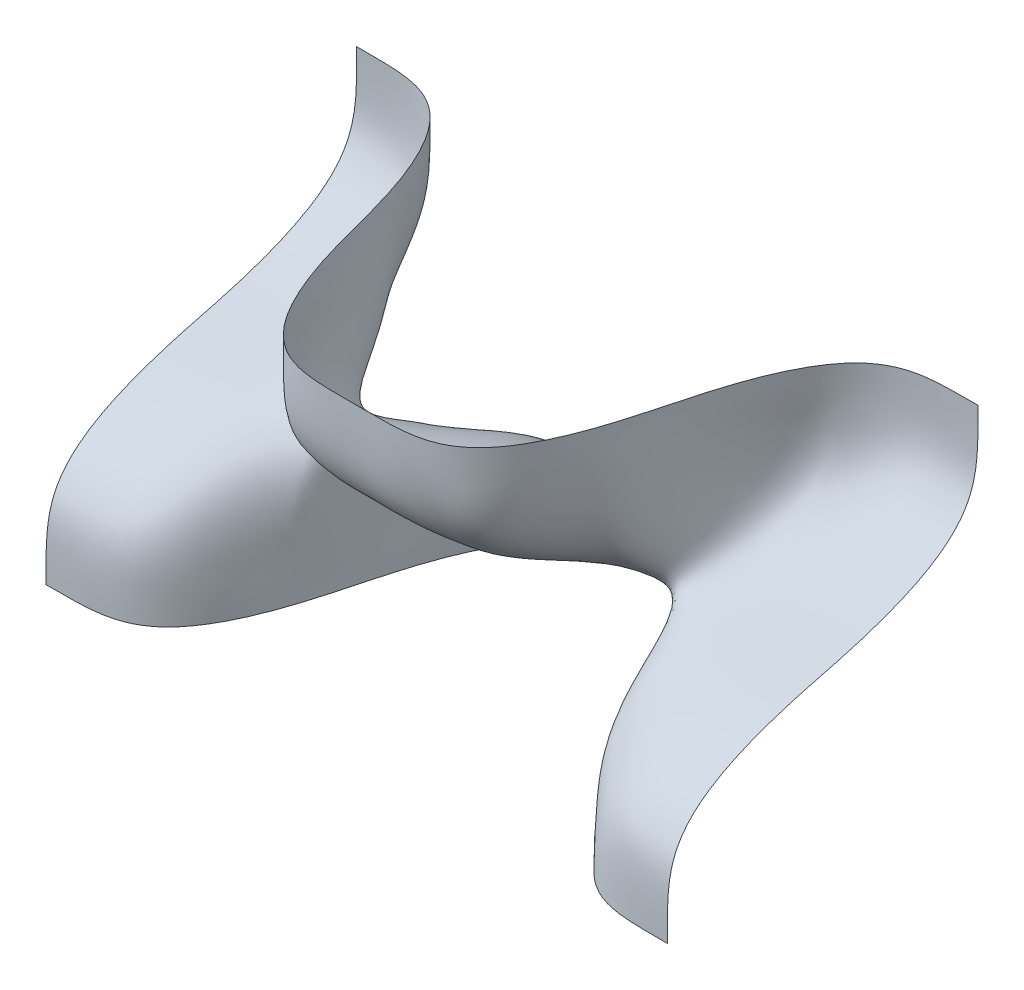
SolidWorks part; units mm, degrees
ref_plane "Ebene vorne" through (0, 0, 0) normal (0, 0, 1) x (1, 0, 0)
ref_plane "Ebene oben" through (0, 0, 0) normal (0, 1, 0) x (1, 0, 0)
ref_plane "Ebene rechts" through (0, 0, 0) normal (1, 0, 0) x (0, 0, -1)
sketch3d "3D-Skizze2"
  point P0 (-120, -120, 60)
  point P1 (-114, -120, 59.994)
  point P2 (-108, -120, 59.904)
  point P3 (-102, -120, 59.514)
  point P4 (-96, -120, 58.464)
  point P5 (-90, -120, 56.25)
  point P6 (-84, -120, 52.224)
  point P7 (-78, -120, 45.594)
  point P8 (-72, -120, 35.424)
  point P9 (-66, -120, 20.634)
  point P10 (-60, -120, 0)
  point P11 (-54, -120, -20.634)
  point P12 (-48, -120, -35.424)
  point P13 (-42, -120, -45.594)
  point P14 (-36, -120, -52.224)
  point P15 (-30, -120, -56.25)
  point P16 (-24, -120, -58.464)
  point P17 (-18, -120, -59.514)
  point P18 (-12, -120, -59.904)
  point P19 (-6, -120, -59.994)
  point P20 (0, -120, -60)
  point P21 (6, -120, -59.994)
  point P22 (12, -120, -59.904)
  point P23 (18, -120, -59.514)
  point P24 (24, -120, -58.464)
  point P25 (30, -120, -56.25)
  point P26 (36, -120, -52.224)
  point P27 (42, -120, -45.594)
  point P28 (48, -120, -35.424)
  point P29 (54, -120, -20.634)
  point P30 (60, -120, 0)
  point P31 (66, -120, 20.634)
  point P32 (72, -120, 35.424)
  point P33 (78, -120, 45.594)
  point P34 (84, -120, 52.224)
  point P35 (90, -120, 56.25)
  point P36 (96, -120, 58.464)
  point P37 (102, -120, 59.514)
  point P38 (108, -120, 59.904)
  point P39 (114, -120, 59.994)
  point P40 (120, -120, 60)
  point P41 (-120, -117, 59.9996)
  point P42 (-114, -117, 59.9936)
  point P43 (-108, -117, 59.9036)
  point P44 (-102, -117, 59.5136)
  point P45 (-96, -117, 58.4636)
  point P46 (-90, -117, 56.2496)
  point P47 (-84, -117, 52.2237)
  point P48 (-78, -117, 45.5937)
  point P49 (-72, -117, 35.4238)
  point P50 (-66, -117, 20.6339)
  point P51 (-60, -117, 0)
  point P52 (-54, -117, -20.6339)
  point P53 (-48, -117, -35.4238)
  point P54 (-42, -117, -45.5937)
  point P55 (-36, -117, -52.2237)
  point P56 (-30, -117, -56.2496)
  point P57 (-24, -117, -58.4636)
  point P58 (-18, -117, -59.5136)
  point P59 (-12, -117, -59.9036)
  point P60 (-6, -117, -59.9936)
  point P61 (0, -117, -59.9996)
  point P62 (6, -117, -59.9936)
  point P63 (12, -117, -59.9036)
  point P64 (18, -117, -59.5136)
  point P65 (24, -117, -58.4636)
  point P66 (30, -117, -56.2496)
  point P67 (36, -117, -52.2237)
  point P68 (42, -117, -45.5937)
  point P69 (48, -117, -35.4238)
  point P70 (54, -117, -20.6339)
  point P71 (60, -117, 0)
  point P72 (66, -117, 20.6339)
  point P73 (72, -117, 35.4238)
  point P74 (78, -117, 45.5937)
  point P75 (84, -117, 52.2237)
  point P76 (90, -117, 56.2496)
  point P77 (96, -117, 58.4636)
  point P78 (102, -117, 59.5136)
  point P79 (108, -117, 59.9036)
  point P80 (114, -117, 59.9936)
  point P81 (120, -117, 59.9996)
  point P82 (-120, -114, 59.994)
  point P83 (-114, -114, 59.988)
  point P84 (-108, -114, 59.898)
  point P85 (-102, -114, 59.508)
  point P86 (-96, -114, 58.4582)
  point P87 (-90, -114, 56.2444)
  point P88 (-84, -114, 52.2188)
  point P89 (-78, -114, 45.5894)
  point P90 (-72, -114, 35.4205)
  point P91 (-66, -114, 20.6319)
  point P92 (-60, -114, 0)
  point P93 (-54, -114, -20.6319)
  point P94 (-48, -114, -35.4205)
  point P95 (-42, -114, -45.5894)
  point P96 (-36, -114, -52.2188)
  point P97 (-30, -114, -56.2444)
  point P98 (-24, -114, -58.4582)
  point P99 (-18, -114, -59.508)
  point P100 (-12, -114, -59.898)
  point P101 (-6, -114, -59.988)
  point P102 (0, -114, -59.994)
  point P103 (6, -114, -59.988)
  point P104 (12, -114, -59.898)
  point P105 (18, -114, -59.508)
  point P106 (24, -114, -58.4582)
  point P107 (30, -114, -56.2444)
  point P108 (36, -114, -52.2188)
  point P109 (42, -114, -45.5894)
  point P110 (48, -114, -35.4205)
  point P111 (54, -114, -20.6319)
  point P112 (60, -114, 0)
  point P113 (66, -114, 20.6319)
  point P114 (72, -114, 35.4205)
  point P115 (78, -114, 45.5894)
  point P116 (84, -114, 52.2188)
  point P117 (90, -114, 56.2444)
  point P118 (96, -114, 58.4582)
  point P119 (102, -114, 59.508)
  point P120 (108, -114, 59.898)
  point P121 (114, -114, 59.988)
  point P122 (120, -114, 59.994)
  point P123 (-120, -111, 59.9696)
  point P124 (-114, -111, 59.9636)
  point P125 (-108, -111, 59.8737)
  point P126 (-102, -111, 59.4839)
  point P127 (-96, -111, 58.4344)
  point P128 (-90, -111, 56.2215)
  point P129 (-84, -111, 52.1976)
  point P130 (-78, -111, 45.5709)
  point P131 (-72, -111, 35.4061)
  point P132 (-66, -111, 20.6236)
  point P133 (-60, -111, 0)
  point P134 (-54, -111, -20.6236)
  point P135 (-48, -111, -35.4061)
  point P136 (-42, -111, -45.5709)
  point P137 (-36, -111, -52.1976)
  point P138 (-30, -111, -56.2215)
  point P139 (-24, -111, -58.4344)
  point P140 (-18, -111, -59.4839)
  point P141 (-12, -111, -59.8737)
  point P142 (-6, -111, -59.9636)
  point P143 (0, -111, -59.9696)
  point P144 (6, -111, -59.9636)
  point P145 (12, -111, -59.8737)
  point P146 (18, -111, -59.4839)
  point P147 (24, -111, -58.4344)
  point P148 (30, -111, -56.2215)
  point P149 (36, -111, -52.1976)
  point P150 (42, -111, -45.5709)
  point P151 (48, -111, -35.4061)
  point P152 (54, -111, -20.6236)
  point P153 (60, -111, 0)
  point P154 (66, -111, 20.6236)
  point P155 (72, -111, 35.4061)
  point P156 (78, -111, 45.5709)
  point P157 (84, -111, 52.1976)
  point P158 (90, -111, 56.2215)
  point P159 (96, -111, 58.4344)
  point P160 (102, -111, 59.4839)
  point P161 (108, -111, 59.8737)
  point P162 (114, -111, 59.9636)
  point P163 (120, -111, 59.9696)
  point P164 (-120, -108, 59.904)
  point P165 (-114, -108, 59.898)
  point P166 (-108, -108, 59.8082)
  point P167 (-102, -108, 59.4188)
  point P168 (-96, -108, 58.3705)
  point P169 (-90, -108, 56.16)
  point P170 (-84, -108, 52.1404)
  point P171 (-78, -108, 45.521)
  point P172 (-72, -108, 35.3673)
  point P173 (-66, -108, 20.601)
  point P174 (-60, -108, 0)
  point P175 (-54, -108, -20.601)
  point P176 (-48, -108, -35.3673)
  point P177 (-42, -108, -45.521)
  point P178 (-36, -108, -52.1404)
  point P179 (-30, -108, -56.16)
  point P180 (-24, -108, -58.3705)
  point P181 (-18, -108, -59.4188)
  point P182 (-12, -108, -59.8082)
  point P183 (-6, -108, -59.898)
  point P184 (0, -108, -59.904)
  point P185 (6, -108, -59.898)
  point P186 (12, -108, -59.8082)
  point P187 (18, -108, -59.4188)
  point P188 (24, -108, -58.3705)
  point P189 (30, -108, -56.16)
  point P190 (36, -108, -52.1404)
  point P191 (42, -108, -45.521)
  point P192 (48, -108, -35.3673)
  point P193 (54, -108, -20.601)
  point P194 (60, -108, 0)
  point P195 (66, -108, 20.601)
  point P196 (72, -108, 35.3673)
  point P197 (78, -108, 45.521)
  point P198 (84, -108, 52.1404)
  point P199 (90, -108, 56.16)
  point P200 (96, -108, 58.3705)
  point P201 (102, -108, 59.4188)
  point P202 (108, -108, 59.8082)
  point P203 (114, -108, 59.898)
  point P204 (120, -108, 59.904)
  point P205 (-120, -105, 59.7656)
  point P206 (-114, -105, 59.7596)
  point P207 (-108, -105, 59.67)
  point P208 (-102, -105, 59.2815)
  point P209 (-96, -105, 58.2356)
  point P210 (-90, -105, 56.0303)
  point P211 (-84, -105, 52.02)
  point P212 (-78, -105, 45.4159)
  point P213 (-72, -105, 35.2856)
  point P214 (-66, -105, 20.5534)
  point P215 (-60, -105, 0)
  point P216 (-54, -105, -20.5534)
  point P217 (-48, -105, -35.2856)
  point P218 (-42, -105, -45.4159)
  point P219 (-36, -105, -52.02)
  point P220 (-30, -105, -56.0303)
  point P221 (-24, -105, -58.2356)
  point P222 (-18, -105, -59.2815)
  point P223 (-12, -105, -59.67)
  point P224 (-6, -105, -59.7596)
  point P225 (0, -105, -59.7656)
  point P226 (6, -105, -59.7596)
  point P227 (12, -105, -59.67)
  point P228 (18, -105, -59.2815)
  point P229 (24, -105, -58.2356)
  point P230 (30, -105, -56.0303)
  point P231 (36, -105, -52.02)
  point P232 (42, -105, -45.4159)
  point P233 (48, -105, -35.2856)
  point P234 (54, -105, -20.5534)
  point P235 (60, -105, 0)
  point P236 (66, -105, 20.5534)
  point P237 (72, -105, 35.2856)
  point P238 (78, -105, 45.4159)
  point P239 (84, -105, 52.02)
  point P240 (90, -105, 56.0303)
  point P241 (96, -105, 58.2356)
  point P242 (102, -105, 59.2815)
  point P243 (108, -105, 59.67)
  point P244 (114, -105, 59.7596)
  point P245 (120, -105, 59.7656)
  point P246 (-120, -102, 59.514)
  point P247 (-114, -102, 59.508)
  point P248 (-108, -102, 59.4188)
  point P249 (-102, -102, 59.0319)
  point P250 (-96, -102, 57.9904)
  point P251 (-90, -102, 55.7944)
  point P252 (-84, -102, 51.801)
  point P253 (-78, -102, 45.2247)
  point P254 (-72, -102, 35.1371)
  point P255 (-66, -102, 20.4669)
  point P256 (-60, -102, 0)
  point P257 (-54, -102, -20.4669)
  point P258 (-48, -102, -35.1371)
  point P259 (-42, -102, -45.2247)
  point P260 (-36, -102, -51.801)
  point P261 (-30, -102, -55.7944)
  point P262 (-24, -102, -57.9904)
  point P263 (-18, -102, -59.0319)
  point P264 (-12, -102, -59.4188)
  point P265 (-6, -102, -59.508)
  point P266 (0, -102, -59.514)
  point P267 (6, -102, -59.508)
  point P268 (12, -102, -59.4188)
  point P269 (18, -102, -59.0319)
  point P270 (24, -102, -57.9904)
  point P271 (30, -102, -55.7944)
  point P272 (36, -102, -51.801)
  point P273 (42, -102, -45.2247)
  point P274 (48, -102, -35.1371)
  point P275 (54, -102, -20.4669)
  point P276 (60, -102, 0)
  point P277 (66, -102, 20.4669)
  point P278 (72, -102, 35.1371)
  point P279 (78, -102, 45.2247)
  point P280 (84, -102, 51.801)
  point P281 (90, -102, 55.7944)
  point P282 (96, -102, 57.9904)
  point P283 (102, -102, 59.0319)
  point P284 (108, -102, 59.4188)
  point P285 (114, -102, 59.508)
  point P286 (120, -102, 59.514)
  point P287 (-120, -99, 59.0996)
  point P288 (-114, -99, 59.0937)
  point P289 (-108, -99, 59.0051)
  point P290 (-102, -99, 58.6209)
  point P291 (-96, -99, 57.5867)
  point P292 (-90, -99, 55.4059)
  point P293 (-84, -99, 51.4403)
  point P294 (-78, -99, 44.9098)
  point P295 (-72, -99, 34.8924)
  point P296 (-66, -99, 20.3244)
  point P297 (-60, -99, 0)
  point P298 (-54, -99, -20.3244)
  point P299 (-48, -99, -34.8924)
  point P300 (-42, -99, -44.9098)
  point P301 (-36, -99, -51.4403)
  point P302 (-30, -99, -55.4059)
  point P303 (-24, -99, -57.5867)
  point P304 (-18, -99, -58.6209)
  point P305 (-12, -99, -59.0051)
  point P306 (-6, -99, -59.0937)
  point P307 (0, -99, -59.0996)
  point P308 (6, -99, -59.0937)
  point P309 (12, -99, -59.0051)
  point P310 (18, -99, -58.6209)
  point P311 (24, -99, -57.5867)
  point P312 (30, -99, -55.4059)
  point P313 (36, -99, -51.4403)
  point P314 (42, -99, -44.9098)
  point P315 (48, -99, -34.8924)
  point P316 (54, -99, -20.3244)
  point P317 (60, -99, 0)
  point P318 (66, -99, 20.3244)
  point P319 (72, -99, 34.8924)
  point P320 (78, -99, 44.9098)
  point P321 (84, -99, 51.4403)
  point P322 (90, -99, 55.4059)
  point P323 (96, -99, 57.5867)
  point P324 (102, -99, 58.6209)
  point P325 (108, -99, 59.0051)
  point P326 (114, -99, 59.0937)
  point P327 (120, -99, 59.0996)
  point P328 (-120, -96, 58.464)
  point P329 (-114, -96, 58.4582)
  point P330 (-108, -96, 58.3705)
  point P331 (-102, -96, 57.9904)
  point P332 (-96, -96, 56.9673)
  point P333 (-90, -96, 54.81)
  point P334 (-84, -96, 50.8871)
  point P335 (-78, -96, 44.4268)
  point P336 (-72, -96, 34.5171)
  point P337 (-66, -96, 20.1058)
  point P338 (-60, -96, 0)
  point P339 (-54, -96, -20.1058)
  point P340 (-48, -96, -34.5171)
  point P341 (-42, -96, -44.4268)
  point P342 (-36, -96, -50.8871)
  point P343 (-30, -96, -54.81)
  point P344 (-24, -96, -56.9673)
  point P345 (-18, -96, -57.9904)
  point P346 (-12, -96, -58.3705)
  point P347 (-6, -96, -58.4582)
  point P348 (0, -96, -58.464)
  point P349 (6, -96, -58.4582)
  point P350 (12, -96, -58.3705)
  point P351 (18, -96, -57.9904)
  point P352 (24, -96, -56.9673)
  point P353 (30, -96, -54.81)
  point P354 (36, -96, -50.8871)
  point P355 (42, -96, -44.4268)
  point P356 (48, -96, -34.5171)
  point P357 (54, -96, -20.1058)
  point P358 (60, -96, 0)
  point P359 (66, -96, 20.1058)
  point P360 (72, -96, 34.5171)
  point P361 (78, -96, 44.4268)
  point P362 (84, -96, 50.8871)
  point P363 (90, -96, 54.81)
  point P364 (96, -96, 56.9673)
  point P365 (102, -96, 57.9904)
  point P366 (108, -96, 58.3705)
  point P367 (114, -96, 58.4582)
  point P368 (120, -96, 58.464)
  point P369 (-120, -93, 57.5396)
  point P370 (-114, -93, 57.5339)
  point P371 (-108, -93, 57.4476)
  point P372 (-102, -93, 57.0736)
  point P373 (-96, -93, 56.0666)
  point P374 (-90, -93, 53.9434)
  point P375 (-84, -93, 50.0825)
  point P376 (-78, -93, 43.7244)
  point P377 (-72, -93, 33.9714)
  point P378 (-66, -93, 19.7879)
  point P379 (-60, -93, 0)
  point P380 (-54, -93, -19.7879)
  point P381 (-48, -93, -33.9714)
  point P382 (-42, -93, -43.7244)
  point P383 (-36, -93, -50.0825)
  point P384 (-30, -93, -53.9434)
  point P385 (-24, -93, -56.0666)
  point P386 (-18, -93, -57.0736)
  point P387 (-12, -93, -57.4476)
  point P388 (-6, -93, -57.5339)
  point P389 (0, -93, -57.5396)
  point P390 (6, -93, -57.5339)
  point P391 (12, -93, -57.4476)
  point P392 (18, -93, -57.0736)
  point P393 (24, -93, -56.0666)
  point P394 (30, -93, -53.9434)
  point P395 (36, -93, -50.0825)
  point P396 (42, -93, -43.7244)
  point P397 (48, -93, -33.9714)
  point P398 (54, -93, -19.7879)
  point P399 (60, -93, 0)
  point P400 (66, -93, 19.7879)
  point P401 (72, -93, 33.9714)
  point P402 (78, -93, 43.7244)
  point P403 (84, -93, 50.0825)
  point P404 (90, -93, 53.9434)
  point P405 (96, -93, 56.0666)
  point P406 (102, -93, 57.0736)
  point P407 (108, -93, 57.4476)
  point P408 (114, -93, 57.5339)
  point P409 (120, -93, 57.5396)
  point P410 (-120, -90, 56.25)
  point P411 (-114, -90, 56.2444)
  point P412 (-108, -90, 56.16)
  point P413 (-102, -90, 55.7944)
  point P414 (-96, -90, 54.81)
  point P415 (-90, -90, 52.7344)
  point P416 (-84, -90, 48.96)
  point P417 (-78, -90, 42.7444)
  point P418 (-72, -90, 33.21)
  point P419 (-66, -90, 19.3444)
  point P420 (-60, -90, 0)
  point P421 (-54, -90, -19.3444)
  point P422 (-48, -90, -33.21)
  point P423 (-42, -90, -42.7444)
  point P424 (-36, -90, -48.96)
  point P425 (-30, -90, -52.7344)
  point P426 (-24, -90, -54.81)
  point P427 (-18, -90, -55.7944)
  point P428 (-12, -90, -56.16)
  point P429 (-6, -90, -56.2444)
  point P430 (0, -90, -56.25)
  point P431 (6, -90, -56.2444)
  point P432 (12, -90, -56.16)
  point P433 (18, -90, -55.7944)
  point P434 (24, -90, -54.81)
  point P435 (30, -90, -52.7344)
  point P436 (36, -90, -48.96)
  point P437 (42, -90, -42.7444)
  point P438 (48, -90, -33.21)
  point P439 (54, -90, -19.3444)
  point P440 (60, -90, 0)
  point P441 (66, -90, 19.3444)
  point P442 (72, -90, 33.21)
  point P443 (78, -90, 42.7444)
  point P444 (84, -90, 48.96)
  point P445 (90, -90, 52.7344)
  point P446 (96, -90, 54.81)
  point P447 (102, -90, 55.7944)
  point P448 (108, -90, 56.16)
  point P449 (114, -90, 56.2444)
  point P450 (120, -90, 56.25)
  point P451 (-120, -87, 54.5096)
  point P452 (-114, -87, 54.5042)
  point P453 (-108, -87, 54.4224)
  point P454 (-102, -87, 54.0681)
  point P455 (-96, -87, 53.1142)
  point P456 (-90, -87, 51.1028)
  point P457 (-84, -87, 47.4452)
  point P458 (-78, -87, 41.4219)
  point P459 (-72, -87, 32.1825)
  point P460 (-66, -87, 18.7459)
  point P461 (-60, -87, 0)
  point P462 (-54, -87, -18.7459)
  point P463 (-48, -87, -32.1825)
  point P464 (-42, -87, -41.4219)
  point P465 (-36, -87, -47.4452)
  point P466 (-30, -87, -51.1028)
  point P467 (-24, -87, -53.1142)
  point P468 (-18, -87, -54.0681)
  point P469 (-12, -87, -54.4224)
  point P470 (-6, -87, -54.5042)
  point P471 (0, -87, -54.5096)
  point P472 (6, -87, -54.5042)
  point P473 (12, -87, -54.4224)
  point P474 (18, -87, -54.0681)
  point P475 (24, -87, -53.1142)
  point P476 (30, -87, -51.1028)
  point P477 (36, -87, -47.4452)
  point P478 (42, -87, -41.4219)
  point P479 (48, -87, -32.1825)
  point P480 (54, -87, -18.7459)
  point P481 (60, -87, 0)
  point P482 (66, -87, 18.7459)
  point P483 (72, -87, 32.1825)
  point P484 (78, -87, 41.4219)
  point P485 (84, -87, 47.4452)
  point P486 (90, -87, 51.1028)
  point P487 (96, -87, 53.1142)
  point P488 (102, -87, 54.0681)
  point P489 (108, -87, 54.4224)
  point P490 (114, -87, 54.5042)
  point P491 (120, -87, 54.5096)
  point P492 (-120, -84, 52.224)
  point P493 (-114, -84, 52.2188)
  point P494 (-108, -84, 52.1404)
  point P495 (-102, -84, 51.801)
  point P496 (-96, -84, 50.8871)
  point P497 (-90, -84, 48.96)
  point P498 (-84, -84, 45.4558)
  point P499 (-78, -84, 39.685)
  point P500 (-72, -84, 30.833)
  point P501 (-66, -84, 17.9598)
  point P502 (-60, -84, 0)
  point P503 (-54, -84, -17.9598)
  point P504 (-48, -84, -30.833)
  point P505 (-42, -84, -39.685)
  point P506 (-36, -84, -45.4558)
  point P507 (-30, -84, -48.96)
  point P508 (-24, -84, -50.8871)
  point P509 (-18, -84, -51.801)
  point P510 (-12, -84, -52.1404)
  point P511 (-6, -84, -52.2188)
  point P512 (0, -84, -52.224)
  point P513 (6, -84, -52.2188)
  point P514 (12, -84, -52.1404)
  point P515 (18, -84, -51.801)
  point P516 (24, -84, -50.8871)
  point P517 (30, -84, -48.96)
  point P518 (36, -84, -45.4558)
  point P519 (42, -84, -39.685)
  point P520 (48, -84, -30.833)
  point P521 (54, -84, -17.9598)
  point P522 (60, -84, 0)
  point P523 (66, -84, 17.9598)
  point P524 (72, -84, 30.833)
  point P525 (78, -84, 39.685)
  point P526 (84, -84, 45.4558)
  point P527 (90, -84, 48.96)
  point P528 (96, -84, 50.8871)
  point P529 (102, -84, 51.801)
  point P530 (108, -84, 52.1404)
  point P531 (114, -84, 52.2188)
  point P532 (120, -84, 52.224)
  point P533 (-120, -81, 49.2896)
  point P534 (-114, -81, 49.2847)
  point P535 (-108, -81, 49.2108)
  point P536 (-102, -81, 48.8904)
  point P537 (-96, -81, 48.0278)
  point P538 (-90, -81, 46.209)
  point P539 (-84, -81, 42.9017)
  point P540 (-78, -81, 37.4552)
  point P541 (-72, -81, 29.1006)
  point P542 (-66, -81, 16.9507)
  point P543 (-60, -81, 0)
  point P544 (-54, -81, -16.9507)
  point P545 (-48, -81, -29.1006)
  point P546 (-42, -81, -37.4552)
  point P547 (-36, -81, -42.9017)
  point P548 (-30, -81, -46.209)
  point P549 (-24, -81, -48.0278)
  point P550 (-18, -81, -48.8904)
  point P551 (-12, -81, -49.2108)
  point P552 (-6, -81, -49.2847)
  point P553 (0, -81, -49.2896)
  point P554 (6, -81, -49.2847)
  point P555 (12, -81, -49.2108)
  point P556 (18, -81, -48.8904)
  point P557 (24, -81, -48.0278)
  point P558 (30, -81, -46.209)
  point P559 (36, -81, -42.9017)
  point P560 (42, -81, -37.4552)
  point P561 (48, -81, -29.1006)
  point P562 (54, -81, -16.9507)
  point P563 (60, -81, 0)
  point P564 (66, -81, 16.9507)
  point P565 (72, -81, 29.1006)
  point P566 (78, -81, 37.4552)
  point P567 (84, -81, 42.9017)
  point P568 (90, -81, 46.209)
  point P569 (96, -81, 48.0278)
  point P570 (102, -81, 48.8904)
  point P571 (108, -81, 49.2108)
  point P572 (114, -81, 49.2847)
  point P573 (120, -81, 49.2896)
  point P574 (-120, -78, 45.594)
  point P575 (-114, -78, 45.5894)
  point P576 (-108, -78, 45.521)
  point P577 (-102, -78, 45.2247)
  point P578 (-96, -78, 44.4268)
  point P579 (-90, -78, 42.7444)
  point P580 (-84, -78, 39.685)
  point P581 (-78, -78, 34.6469)
  point P582 (-72, -78, 26.9187)
  point P583 (-66, -78, 15.6798)
  point P584 (-60, -78, 0)
  point P585 (-54, -78, -15.6798)
  point P586 (-48, -78, -26.9187)
  point P587 (-42, -78, -34.6469)
  point P588 (-36, -78, -39.685)
  point P589 (-30, -78, -42.7444)
  point P590 (-24, -78, -44.4268)
  point P591 (-18, -78, -45.2247)
  point P592 (-12, -78, -45.521)
  point P593 (-6, -78, -45.5894)
  point P594 (0, -78, -45.594)
  point P595 (6, -78, -45.5894)
  point P596 (12, -78, -45.521)
  point P597 (18, -78, -45.2247)
  point P598 (24, -78, -44.4268)
  point P599 (30, -78, -42.7444)
  point P600 (36, -78, -39.685)
  point P601 (42, -78, -34.6469)
  point P602 (48, -78, -26.9187)
  point P603 (54, -78, -15.6798)
  point P604 (60, -78, 0)
  point P605 (66, -78, 15.6798)
  point P606 (72, -78, 26.9187)
  point P607 (78, -78, 34.6469)
  point P608 (84, -78, 39.685)
  point P609 (90, -78, 42.7444)
  point P610 (96, -78, 44.4268)
  point P611 (102, -78, 45.2247)
  point P612 (108, -78, 45.521)
  point P613 (114, -78, 45.5894)
  point P614 (120, -78, 45.594)
  point P615 (-120, -75, 41.0156)
  point P616 (-114, -75, 41.0115)
  point P617 (-108, -75, 40.95)
  point P618 (-102, -75, 40.6834)
  point P619 (-96, -75, 39.9656)
  point P620 (-90, -75, 38.4521)
  point P621 (-84, -75, 35.7)
  point P622 (-78, -75, 31.1678)
  point P623 (-72, -75, 24.2156)
  point P624 (-66, -75, 14.1053)
  point P625 (-60, -75, 0)
  point P626 (-54, -75, -14.1053)
  point P627 (-48, -75, -24.2156)
  point P628 (-42, -75, -31.1678)
  point P629 (-36, -75, -35.7)
  point P630 (-30, -75, -38.4521)
  point P631 (-24, -75, -39.9656)
  point P632 (-18, -75, -40.6834)
  point P633 (-12, -75, -40.95)
  point P634 (-6, -75, -41.0115)
  point P635 (0, -75, -41.0156)
  point P636 (6, -75, -41.0115)
  point P637 (12, -75, -40.95)
  point P638 (18, -75, -40.6834)
  point P639 (24, -75, -39.9656)
  point P640 (30, -75, -38.4521)
  point P641 (36, -75, -35.7)
  point P642 (42, -75, -31.1678)
  point P643 (48, -75, -24.2156)
  point P644 (54, -75, -14.1053)
  point P645 (60, -75, 0)
  point P646 (66, -75, 14.1053)
  point P647 (72, -75, 24.2156)
  point P648 (78, -75, 31.1678)
  point P649 (84, -75, 35.7)
  point P650 (90, -75, 38.4521)
  point P651 (96, -75, 39.9656)
  point P652 (102, -75, 40.6834)
  point P653 (108, -75, 40.95)
  point P654 (114, -75, 41.0115)
  point P655 (120, -75, 41.0156)
  point P656 (-120, -72, 35.424)
  point P657 (-114, -72, 35.4205)
  point P658 (-108, -72, 35.3673)
  point P659 (-102, -72, 35.1371)
  point P660 (-96, -72, 34.5171)
  point P661 (-90, -72, 33.21)
  point P662 (-84, -72, 30.833)
  point P663 (-78, -72, 26.9187)
  point P664 (-72, -72, 20.9143)
  point P665 (-66, -72, 12.1823)
  point P666 (-60, -72, 0)
  point P667 (-54, -72, -12.1823)
  point P668 (-48, -72, -20.9143)
  point P669 (-42, -72, -26.9187)
  point P670 (-36, -72, -30.833)
  point P671 (-30, -72, -33.21)
  point P672 (-24, -72, -34.5171)
  point P673 (-18, -72, -35.1371)
  point P674 (-12, -72, -35.3673)
  point P675 (-6, -72, -35.4205)
  point P676 (0, -72, -35.424)
  point P677 (6, -72, -35.4205)
  point P678 (12, -72, -35.3673)
  point P679 (18, -72, -35.1371)
  point P680 (24, -72, -34.5171)
  point P681 (30, -72, -33.21)
  point P682 (36, -72, -30.833)
  point P683 (42, -72, -26.9187)
  point P684 (48, -72, -20.9143)
  point P685 (54, -72, -12.1823)
  point P686 (60, -72, 0)
  point P687 (66, -72, 12.1823)
  point P688 (72, -72, 20.9143)
  point P689 (78, -72, 26.9187)
  point P690 (84, -72, 30.833)
  point P691 (90, -72, 33.21)
  point P692 (96, -72, 34.5171)
  point P693 (102, -72, 35.1371)
  point P694 (108, -72, 35.3673)
  point P695 (114, -72, 35.4205)
  point P696 (120, -72, 35.424)
  point P697 (-120, -69, 28.6796)
  point P698 (-114, -69, 28.6768)
  point P699 (-108, -69, 28.6337)
  point P700 (-102, -69, 28.4473)
  point P701 (-96, -69, 27.9454)
  point P702 (-90, -69, 26.8871)
  point P703 (-84, -69, 24.9627)
  point P704 (-78, -69, 21.7936)
  point P705 (-72, -69, 16.9325)
  point P706 (-66, -69, 9.8629)
  point P707 (-60, -69, 0)
  point P708 (-54, -69, -9.8629)
  point P709 (-48, -69, -16.9325)
  point P710 (-42, -69, -21.7936)
  point P711 (-36, -69, -24.9627)
  point P712 (-30, -69, -26.8871)
  point P713 (-24, -69, -27.9454)
  point P714 (-18, -69, -28.4473)
  point P715 (-12, -69, -28.6337)
  point P716 (-6, -69, -28.6768)
  point P717 (0, -69, -28.6796)
  point P718 (6, -69, -28.6768)
  point P719 (12, -69, -28.6337)
  point P720 (18, -69, -28.4473)
  point P721 (24, -69, -27.9454)
  point P722 (30, -69, -26.8871)
  point P723 (36, -69, -24.9627)
  point P724 (42, -69, -21.7936)
  point P725 (48, -69, -16.9325)
  point P726 (54, -69, -9.8629)
  point P727 (60, -69, 0)
  point P728 (66, -69, 9.8629)
  point P729 (72, -69, 16.9325)
  point P730 (78, -69, 21.7936)
  point P731 (84, -69, 24.9627)
  point P732 (90, -69, 26.8871)
  point P733 (96, -69, 27.9454)
  point P734 (102, -69, 28.4473)
  point P735 (108, -69, 28.6337)
  point P736 (114, -69, 28.6768)
  point P737 (120, -69, 28.6796)
  point P738 (-120, -66, 20.634)
  point P739 (-114, -66, 20.6319)
  point P740 (-108, -66, 20.601)
  point P741 (-102, -66, 20.4669)
  point P742 (-96, -66, 20.1058)
  point P743 (-90, -66, 19.3444)
  point P744 (-84, -66, 17.9598)
  point P745 (-78, -66, 15.6798)
  point P746 (-72, -66, 12.1823)
  point P747 (-66, -66, 7.096)
  point P748 (-60, -66, 0)
  point P749 (-54, -66, -7.096)
  point P750 (-48, -66, -12.1823)
  point P751 (-42, -66, -15.6798)
  point P752 (-36, -66, -17.9598)
  point P753 (-30, -66, -19.3444)
  point P754 (-24, -66, -20.1058)
  point P755 (-18, -66, -20.4669)
  point P756 (-12, -66, -20.601)
  point P757 (-6, -66, -20.6319)
  point P758 (0, -66, -20.634)
  point P759 (6, -66, -20.6319)
  point P760 (12, -66, -20.601)
  point P761 (18, -66, -20.4669)
  point P762 (24, -66, -20.1058)
  point P763 (30, -66, -19.3444)
  point P764 (36, -66, -17.9598)
  point P765 (42, -66, -15.6798)
  point P766 (48, -66, -12.1823)
  point P767 (54, -66, -7.096)
  point P768 (60, -66, 0)
  point P769 (66, -66, 7.096)
  point P770 (72, -66, 12.1823)
  point P771 (78, -66, 15.6798)
  point P772 (84, -66, 17.9598)
  point P773 (90, -66, 19.3444)
  point P774 (96, -66, 20.1058)
  point P775 (102, -66, 20.4669)
  point P776 (108, -66, 20.601)
  point P777 (114, -66, 20.6319)
  point P778 (120, -66, 20.634)
  point P779 (-120, -63, 11.1296)
  point P780 (-114, -63, 11.1285)
  point P781 (-108, -63, 11.1118)
  point P782 (-102, -63, 11.0395)
  point P783 (-96, -63, 10.8447)
  point P784 (-90, -63, 10.434)
  point P785 (-84, -63, 9.6872)
  point P786 (-78, -63, 8.4574)
  point P787 (-72, -63, 6.5709)
  point P788 (-66, -63, 3.8275)
  point P789 (-60, -63, 0)
  point P790 (-54, -63, -3.8275)
  point P791 (-48, -63, -6.5709)
  point P792 (-42, -63, -8.4574)
  point P793 (-36, -63, -9.6872)
  point P794 (-30, -63, -10.434)
  point P795 (-24, -63, -10.8447)
  point P796 (-18, -63, -11.0395)
  point P797 (-12, -63, -11.1118)
  point P798 (-6, -63, -11.1285)
  point P799 (0, -63, -11.1296)
  point P800 (6, -63, -11.1285)
  point P801 (12, -63, -11.1118)
  point P802 (18, -63, -11.0395)
  point P803 (24, -63, -10.8447)
  point P804 (30, -63, -10.434)
  point P805 (36, -63, -9.6872)
  point P806 (42, -63, -8.4574)
  point P807 (48, -63, -6.5709)
  point P808 (54, -63, -3.8275)
  point P809 (60, -63, 0)
  point P810 (66, -63, 3.8275)
  point P811 (72, -63, 6.5709)
  point P812 (78, -63, 8.4574)
  point P813 (84, -63, 9.6872)
  point P814 (90, -63, 10.434)
  point P815 (96, -63, 10.8447)
  point P816 (102, -63, 11.0395)
  point P817 (108, -63, 11.1118)
  point P818 (114, -63, 11.1285)
  point P819 (120, -63, 11.1296)
  point P820 (-120, -60, 0)
  point P821 (-114, -60, 0)
  point P822 (-108, -60, 0)
  point P823 (-102, -60, 0)
  point P824 (-96, -60, 0)
  point P825 (-90, -60, 0)
  point P826 (-84, -60, 0)
  point P827 (-78, -60, 0)
  point P828 (-72, -60, 0)
  point P829 (-66, -60, 0)
  point P830 (-60, -60, 0)
  point P831 (-54, -60, 0)
  point P832 (-48, -60, 0)
  point P833 (-42, -60, 0)
  point P834 (-36, -60, 0)
  point P835 (-30, -60, 0)
  point P836 (-24, -60, 0)
  point P837 (-18, -60, 0)
  point P838 (-12, -60, 0)
  point P839 (-6, -60, 0)
  point P840 (0, -60, 0)
  point P841 (6, -60, 0)
  point P842 (12, -60, 0)
  point P843 (18, -60, 0)
  point P844 (24, -60, 0)
  point P845 (30, -60, 0)
  point P846 (36, -60, 0)
  point P847 (42, -60, 0)
  point P848 (48, -60, 0)
  point P849 (54, -60, 0)
  point P850 (60, -60, 0)
  point P851 (66, -60, 0)
  point P852 (72, -60, 0)
  point P853 (78, -60, 0)
  point P854 (84, -60, 0)
  point P855 (90, -60, 0)
  point P856 (96, -60, 0)
  point P857 (102, -60, 0)
  point P858 (108, -60, 0)
  point P859 (114, -60, 0)
  point P860 (120, -60, 0)
  point P861 (-120, -57, -11.1296)
  point P862 (-114, -57, -11.1285)
  point P863 (-108, -57, -11.1118)
  point P864 (-102, -57, -11.0395)
  point P865 (-96, -57, -10.8447)
  point P866 (-90, -57, -10.434)
  point P867 (-84, -57, -9.6872)
  point P868 (-78, -57, -8.4574)
  point P869 (-72, -57, -6.5709)
  point P870 (-66, -57, -3.8275)
  point P871 (-60, -57, 0)
  point P872 (-54, -57, 3.8275)
  point P873 (-48, -57, 6.5709)
  point P874 (-42, -57, 8.4574)
  point P875 (-36, -57, 9.6872)
  point P876 (-30, -57, 10.434)
  point P877 (-24, -57, 10.8447)
  point P878 (-18, -57, 11.0395)
  point P879 (-12, -57, 11.1118)
  point P880 (-6, -57, 11.1285)
  point P881 (0, -57, 11.1296)
  point P882 (6, -57, 11.1285)
  point P883 (12, -57, 11.1118)
  point P884 (18, -57, 11.0395)
  point P885 (24, -57, 10.8447)
  point P886 (30, -57, 10.434)
  point P887 (36, -57, 9.6872)
  point P888 (42, -57, 8.4574)
  point P889 (48, -57, 6.5709)
  point P890 (54, -57, 3.8275)
  point P891 (60, -57, 0)
  point P892 (66, -57, -3.8275)
  point P893 (72, -57, -6.5709)
  point P894 (78, -57, -8.4574)
  point P895 (84, -57, -9.6872)
  point P896 (90, -57, -10.434)
  point P897 (96, -57, -10.8447)
  point P898 (102, -57, -11.0395)
  point P899 (108, -57, -11.1118)
  point P900 (114, -57, -11.1285)
  point P901 (120, -57, -11.1296)
  point P902 (-120, -54, -20.634)
  point P903 (-114, -54, -20.6319)
  point P904 (-108, -54, -20.601)
  point P905 (-102, -54, -20.4669)
  point P906 (-96, -54, -20.1058)
  point P907 (-90, -54, -19.3444)
  point P908 (-84, -54, -17.9598)
  point P909 (-78, -54, -15.6798)
  point P910 (-72, -54, -12.1823)
  point P911 (-66, -54, -7.096)
  point P912 (-60, -54, 0)
  point P913 (-54, -54, 7.096)
  point P914 (-48, -54, 12.1823)
  point P915 (-42, -54, 15.6798)
  point P916 (-36, -54, 17.9598)
  point P917 (-30, -54, 19.3444)
  point P918 (-24, -54, 20.1058)
  point P919 (-18, -54, 20.4669)
  point P920 (-12, -54, 20.601)
  point P921 (-6, -54, 20.6319)
  point P922 (0, -54, 20.634)
  point P923 (6, -54, 20.6319)
  point P924 (12, -54, 20.601)
  point P925 (18, -54, 20.4669)
  point P926 (24, -54, 20.1058)
  point P927 (30, -54, 19.3444)
  point P928 (36, -54, 17.9598)
  point P929 (42, -54, 15.6798)
  point P930 (48, -54, 12.1823)
  point P931 (54, -54, 7.096)
  point P932 (60, -54, 0)
  point P933 (66, -54, -7.096)
  point P934 (72, -54, -12.1823)
  point P935 (78, -54, -15.6798)
  point P936 (84, -54, -17.9598)
  point P937 (90, -54, -19.3444)
  point P938 (96, -54, -20.1058)
  point P939 (102, -54, -20.4669)
  point P940 (108, -54, -20.601)
  point P941 (114, -54, -20.6319)
  point P942 (120, -54, -20.634)
  point P943 (-120, -51, -28.6796)
  point P944 (-114, -51, -28.6768)
  point P945 (-108, -51, -28.6337)
  point P946 (-102, -51, -28.4473)
  point P947 (-96, -51, -27.9454)
  point P948 (-90, -51, -26.8871)
  point P949 (-84, -51, -24.9627)
  point P950 (-78, -51, -21.7936)
  point P951 (-72, -51, -16.9325)
  point P952 (-66, -51, -9.8629)
  point P953 (-60, -51, 0)
  point P954 (-54, -51, 9.8629)
  point P955 (-48, -51, 16.9325)
  point P956 (-42, -51, 21.7936)
  point P957 (-36, -51, 24.9627)
  point P958 (-30, -51, 26.8871)
  point P959 (-24, -51, 27.9454)
  point P960 (-18, -51, 28.4473)
  point P961 (-12, -51, 28.6337)
  point P962 (-6, -51, 28.6768)
  point P963 (0, -51, 28.6796)
  point P964 (6, -51, 28.6768)
  point P965 (12, -51, 28.6337)
  point P966 (18, -51, 28.4473)
  point P967 (24, -51, 27.9454)
  point P968 (30, -51, 26.8871)
  point P969 (36, -51, 24.9627)
  point P970 (42, -51, 21.7936)
  point P971 (48, -51, 16.9325)
  point P972 (54, -51, 9.8629)
  point P973 (60, -51, 0)
  point P974 (66, -51, -9.8629)
  point P975 (72, -51, -16.9325)
  point P976 (78, -51, -21.7936)
  point P977 (84, -51, -24.9627)
  point P978 (90, -51, -26.8871)
  point P979 (96, -51, -27.9454)
  point P980 (102, -51, -28.4473)
  point P981 (108, -51, -28.6337)
  point P982 (114, -51, -28.6768)
  point P983 (120, -51, -28.6796)
  point P984 (-120, -48, -35.424)
  point P985 (-114, -48, -35.4205)
  point P986 (-108, -48, -35.3673)
  point P987 (-102, -48, -35.1371)
  point P988 (-96, -48, -34.5171)
  point P989 (-90, -48, -33.21)
  point P990 (-84, -48, -30.833)
  point P991 (-78, -48, -26.9187)
  point P992 (-72, -48, -20.9143)
  point P993 (-66, -48, -12.1823)
  point P994 (-60, -48, 0)
  point P995 (-54, -48, 12.1823)
  point P996 (-48, -48, 20.9143)
  point P997 (-42, -48, 26.9187)
  point P998 (-36, -48, 30.833)
  point P999 (-30, -48, 33.21)
  point P1000 (-24, -48, 34.5171)
  point P1001 (-18, -48, 35.1371)
  point P1002 (-12, -48, 35.3673)
  point P1003 (-6, -48, 35.4205)
  point P1004 (0, -48, 35.424)
  point P1005 (6, -48, 35.4205)
  point P1006 (12, -48, 35.3673)
  point P1007 (18, -48, 35.1371)
  point P1008 (24, -48, 34.5171)
  point P1009 (30, -48, 33.21)
  point P1010 (36, -48, 30.833)
  point P1011 (42, -48, 26.9187)
  point P1012 (48, -48, 20.9143)
  point P1013 (54, -48, 12.1823)
  point P1014 (60, -48, 0)
  point P1015 (66, -48, -12.1823)
  point P1016 (72, -48, -20.9143)
  point P1017 (78, -48, -26.9187)
  point P1018 (84, -48, -30.833)
  point P1019 (90, -48, -33.21)
  point P1020 (96, -48, -34.5171)
  point P1021 (102, -48, -35.1371)
  point P1022 (108, -48, -35.3673)
  point P1023 (114, -48, -35.4205)
  point P1024 (120, -48, -35.424)
  point P1025 (-120, -45, -41.0156)
  point P1026 (-114, -45, -41.0115)
  point P1027 (-108, -45, -40.95)
  point P1028 (-102, -45, -40.6834)
  point P1029 (-96, -45, -39.9656)
  point P1030 (-90, -45, -38.4521)
  point P1031 (-84, -45, -35.7)
  point P1032 (-78, -45, -31.1678)
  point P1033 (-72, -45, -24.2156)
  point P1034 (-66, -45, -14.1053)
  point P1035 (-60, -45, 0)
  point P1036 (-54, -45, 14.1053)
  point P1037 (-48, -45, 24.2156)
  point P1038 (-42, -45, 31.1678)
  point P1039 (-36, -45, 35.7)
  point P1040 (-30, -45, 38.4521)
  point P1041 (-24, -45, 39.9656)
  point P1042 (-18, -45, 40.6834)
  point P1043 (-12, -45, 40.95)
  point P1044 (-6, -45, 41.0115)
  point P1045 (0, -45, 41.0156)
  point P1046 (6, -45, 41.0115)
  point P1047 (12, -45, 40.95)
  point P1048 (18, -45, 40.6834)
  point P1049 (24, -45, 39.9656)
  point P1050 (30, -45, 38.4521)
  point P1051 (36, -45, 35.7)
  point P1052 (42, -45, 31.1678)
  point P1053 (48, -45, 24.2156)
  point P1054 (54, -45, 14.1053)
  point P1055 (60, -45, 0)
  point P1056 (66, -45, -14.1053)
  point P1057 (72, -45, -24.2156)
  point P1058 (78, -45, -31.1678)
  point P1059 (84, -45, -35.7)
  point P1060 (90, -45, -38.4521)
  point P1061 (96, -45, -39.9656)
  point P1062 (102, -45, -40.6834)
  point P1063 (108, -45, -40.95)
  point P1064 (114, -45, -41.0115)
  point P1065 (120, -45, -41.0156)
  point P1066 (-120, -42, -45.594)
  point P1067 (-114, -42, -45.5894)
  point P1068 (-108, -42, -45.521)
  point P1069 (-102, -42, -45.2247)
  point P1070 (-96, -42, -44.4268)
  point P1071 (-90, -42, -42.7444)
  point P1072 (-84, -42, -39.685)
  point P1073 (-78, -42, -34.6469)
  point P1074 (-72, -42, -26.9187)
  point P1075 (-66, -42, -15.6798)
  point P1076 (-60, -42, 0)
  point P1077 (-54, -42, 15.6798)
  point P1078 (-48, -42, 26.9187)
  point P1079 (-42, -42, 34.6469)
  point P1080 (-36, -42, 39.685)
  point P1081 (-30, -42, 42.7444)
  point P1082 (-24, -42, 44.4268)
  point P1083 (-18, -42, 45.2247)
  point P1084 (-12, -42, 45.521)
  point P1085 (-6, -42, 45.5894)
  point P1086 (0, -42, 45.594)
  point P1087 (6, -42, 45.5894)
  point P1088 (12, -42, 45.521)
  point P1089 (18, -42, 45.2247)
  point P1090 (24, -42, 44.4268)
  point P1091 (30, -42, 42.7444)
  point P1092 (36, -42, 39.685)
  point P1093 (42, -42, 34.6469)
  point P1094 (48, -42, 26.9187)
  point P1095 (54, -42, 15.6798)
  point P1096 (60, -42, 0)
  point P1097 (66, -42, -15.6798)
  point P1098 (72, -42, -26.9187)
  point P1099 (78, -42, -34.6469)
  point P1100 (84, -42, -39.685)
  point P1101 (90, -42, -42.7444)
  point P1102 (96, -42, -44.4268)
  point P1103 (102, -42, -45.2247)
  point P1104 (108, -42, -45.521)
  point P1105 (114, -42, -45.5894)
  point P1106 (120, -42, -45.594)
  point P1107 (-120, -39, -49.2896)
  point P1108 (-114, -39, -49.2847)
  point P1109 (-108, -39, -49.2108)
  point P1110 (-102, -39, -48.8904)
  point P1111 (-96, -39, -48.0278)
  point P1112 (-90, -39, -46.209)
  point P1113 (-84, -39, -42.9017)
  point P1114 (-78, -39, -37.4552)
  point P1115 (-72, -39, -29.1006)
  point P1116 (-66, -39, -16.9507)
  point P1117 (-60, -39, 0)
  point P1118 (-54, -39, 16.9507)
  point P1119 (-48, -39, 29.1006)
  point P1120 (-42, -39, 37.4552)
  point P1121 (-36, -39, 42.9017)
  point P1122 (-30, -39, 46.209)
  point P1123 (-24, -39, 48.0278)
  point P1124 (-18, -39, 48.8904)
  point P1125 (-12, -39, 49.2108)
  point P1126 (-6, -39, 49.2847)
  point P1127 (0, -39, 49.2896)
  point P1128 (6, -39, 49.2847)
  point P1129 (12, -39, 49.2108)
  point P1130 (18, -39, 48.8904)
  point P1131 (24, -39, 48.0278)
  point P1132 (30, -39, 46.209)
  point P1133 (36, -39, 42.9017)
  point P1134 (42, -39, 37.4552)
  point P1135 (48, -39, 29.1006)
  point P1136 (54, -39, 16.9507)
  point P1137 (60, -39, 0)
  point P1138 (66, -39, -16.9507)
  point P1139 (72, -39, -29.1006)
  point P1140 (78, -39, -37.4552)
  point P1141 (84, -39, -42.9017)
  point P1142 (90, -39, -46.209)
  point P1143 (96, -39, -48.0278)
  point P1144 (102, -39, -48.8904)
  point P1145 (108, -39, -49.2108)
  point P1146 (114, -39, -49.2847)
  point P1147 (120, -39, -49.2896)
  point P1148 (-120, -36, -52.224)
  point P1149 (-114, -36, -52.2188)
  point P1150 (-108, -36, -52.1404)
  point P1151 (-102, -36, -51.801)
  point P1152 (-96, -36, -50.8871)
  point P1153 (-90, -36, -48.96)
  point P1154 (-84, -36, -45.4558)
  point P1155 (-78, -36, -39.685)
  point P1156 (-72, -36, -30.833)
  point P1157 (-66, -36, -17.9598)
  point P1158 (-60, -36, 0)
  point P1159 (-54, -36, 17.9598)
  point P1160 (-48, -36, 30.833)
  point P1161 (-42, -36, 39.685)
  point P1162 (-36, -36, 45.4558)
  point P1163 (-30, -36, 48.96)
  point P1164 (-24, -36, 50.8871)
  point P1165 (-18, -36, 51.801)
  point P1166 (-12, -36, 52.1404)
  point P1167 (-6, -36, 52.2188)
  point P1168 (0, -36, 52.224)
  point P1169 (6, -36, 52.2188)
  point P1170 (12, -36, 52.1404)
  point P1171 (18, -36, 51.801)
  point P1172 (24, -36, 50.8871)
  point P1173 (30, -36, 48.96)
  point P1174 (36, -36, 45.4558)
  point P1175 (42, -36, 39.685)
  point P1176 (48, -36, 30.833)
  point P1177 (54, -36, 17.9598)
  point P1178 (60, -36, 0)
  point P1179 (66, -36, -17.9598)
  point P1180 (72, -36, -30.833)
  point P1181 (78, -36, -39.685)
  point P1182 (84, -36, -45.4558)
  point P1183 (90, -36, -48.96)
  point P1184 (96, -36, -50.8871)
  point P1185 (102, -36, -51.801)
  point P1186 (108, -36, -52.1404)
  point P1187 (114, -36, -52.2188)
  point P1188 (120, -36, -52.224)
  point P1189 (-120, -33, -54.5096)
  point P1190 (-114, -33, -54.5042)
  point P1191 (-108, -33, -54.4224)
  point P1192 (-102, -33, -54.0681)
  point P1193 (-96, -33, -53.1142)
  point P1194 (-90, -33, -51.1028)
  point P1195 (-84, -33, -47.4452)
  point P1196 (-78, -33, -41.4219)
  point P1197 (-72, -33, -32.1825)
  point P1198 (-66, -33, -18.7459)
  point P1199 (-60, -33, 0)
  point P1200 (-54, -33, 18.7459)
  point P1201 (-48, -33, 32.1825)
  point P1202 (-42, -33, 41.4219)
  point P1203 (-36, -33, 47.4452)
  point P1204 (-30, -33, 51.1028)
  point P1205 (-24, -33, 53.1142)
  point P1206 (-18, -33, 54.0681)
  point P1207 (-12, -33, 54.4224)
  point P1208 (-6, -33, 54.5042)
  point P1209 (0, -33, 54.5096)
  point P1210 (6, -33, 54.5042)
  point P1211 (12, -33, 54.4224)
  point P1212 (18, -33, 54.0681)
  point P1213 (24, -33, 53.1142)
  point P1214 (30, -33, 51.1028)
  point P1215 (36, -33, 47.4452)
  point P1216 (42, -33, 41.4219)
  point P1217 (48, -33, 32.1825)
  point P1218 (54, -33, 18.7459)
  point P1219 (60, -33, 0)
  point P1220 (66, -33, -18.7459)
  point P1221 (72, -33, -32.1825)
  point P1222 (78, -33, -41.4219)
  point P1223 (84, -33, -47.4452)
  point P1224 (90, -33, -51.1028)
  point P1225 (96, -33, -53.1142)
  point P1226 (102, -33, -54.0681)
  point P1227 (108, -33, -54.4224)
  point P1228 (114, -33, -54.5042)
  point P1229 (120, -33, -54.5096)
  point P1230 (-120, -30, -56.25)
  point P1231 (-114, -30, -56.2444)
  point P1232 (-108, -30, -56.16)
  point P1233 (-102, -30, -55.7944)
  point P1234 (-96, -30, -54.81)
  point P1235 (-90, -30, -52.7344)
  point P1236 (-84, -30, -48.96)
  point P1237 (-78, -30, -42.7444)
  point P1238 (-72, -30, -33.21)
  point P1239 (-66, -30, -19.3444)
  point P1240 (-60, -30, 0)
  point P1241 (-54, -30, 19.3444)
  point P1242 (-48, -30, 33.21)
  point P1243 (-42, -30, 42.7444)
  point P1244 (-36, -30, 48.96)
  point P1245 (-30, -30, 52.7344)
  point P1246 (-24, -30, 54.81)
  point P1247 (-18, -30, 55.7944)
  point P1248 (-12, -30, 56.16)
  point P1249 (-6, -30, 56.2444)
  point P1250 (0, -30, 56.25)
  point P1251 (6, -30, 56.2444)
  point P1252 (12, -30, 56.16)
  point P1253 (18, -30, 55.7944)
  point P1254 (24, -30, 54.81)
  point P1255 (30, -30, 52.7344)
  point P1256 (36, -30, 48.96)
  point P1257 (42, -30, 42.7444)
  point P1258 (48, -30, 33.21)
  point P1259 (54, -30, 19.3444)
  point P1260 (60, -30, 0)
  point P1261 (66, -30, -19.3444)
  point P1262 (72, -30, -33.21)
  point P1263 (78, -30, -42.7444)
  point P1264 (84, -30, -48.96)
  point P1265 (90, -30, -52.7344)
  point P1266 (96, -30, -54.81)
  point P1267 (102, -30, -55.7944)
  point P1268 (108, -30, -56.16)
  point P1269 (114, -30, -56.2444)
  point P1270 (120, -30, -56.25)
  point P1271 (-120, -27, -57.5396)
  point P1272 (-114, -27, -57.5339)
  point P1273 (-108, -27, -57.4476)
  point P1274 (-102, -27, -57.0736)
  point P1275 (-96, -27, -56.0666)
  point P1276 (-90, -27, -53.9434)
  point P1277 (-84, -27, -50.0825)
  point P1278 (-78, -27, -43.7244)
  point P1279 (-72, -27, -33.9714)
  point P1280 (-66, -27, -19.7879)
  point P1281 (-60, -27, 0)
  point P1282 (-54, -27, 19.7879)
  point P1283 (-48, -27, 33.9714)
  point P1284 (-42, -27, 43.7244)
  point P1285 (-36, -27, 50.0825)
  point P1286 (-30, -27, 53.9434)
  point P1287 (-24, -27, 56.0666)
  point P1288 (-18, -27, 57.0736)
  point P1289 (-12, -27, 57.4476)
  point P1290 (-6, -27, 57.5339)
  point P1291 (0, -27, 57.5396)
  point P1292 (6, -27, 57.5339)
  point P1293 (12, -27, 57.4476)
  point P1294 (18, -27, 57.0736)
  point P1295 (24, -27, 56.0666)
  point P1296 (30, -27, 53.9434)
  point P1297 (36, -27, 50.0825)
  point P1298 (42, -27, 43.7244)
  point P1299 (48, -27, 33.9714)
  point P1300 (54, -27, 19.7879)
  point P1301 (60, -27, 0)
  point P1302 (66, -27, -19.7879)
  point P1303 (72, -27, -33.9714)
  point P1304 (78, -27, -43.7244)
  point P1305 (84, -27, -50.0825)
  point P1306 (90, -27, -53.9434)
  point P1307 (96, -27, -56.0666)
  point P1308 (102, -27, -57.0736)
  point P1309 (108, -27, -57.4476)
  point P1310 (114, -27, -57.5339)
  point P1311 (120, -27, -57.5396)
  point P1312 (-120, -24, -58.464)
  point P1313 (-114, -24, -58.4582)
  point P1314 (-108, -24, -58.3705)
  point P1315 (-102, -24, -57.9904)
  point P1316 (-96, -24, -56.9673)
  point P1317 (-90, -24, -54.81)
  point P1318 (-84, -24, -50.8871)
  point P1319 (-78, -24, -44.4268)
  point P1320 (-72, -24, -34.5171)
  point P1321 (-66, -24, -20.1058)
  point P1322 (-60, -24, 0)
  point P1323 (-54, -24, 20.1058)
  point P1324 (-48, -24, 34.5171)
  point P1325 (-42, -24, 44.4268)
  point P1326 (-36, -24, 50.8871)
  point P1327 (-30, -24, 54.81)
  point P1328 (-24, -24, 56.9673)
  point P1329 (-18, -24, 57.9904)
  point P1330 (-12, -24, 58.3705)
  point P1331 (-6, -24, 58.4582)
  point P1332 (0, -24, 58.464)
  point P1333 (6, -24, 58.4582)
  point P1334 (12, -24, 58.3705)
  point P1335 (18, -24, 57.9904)
  point P1336 (24, -24, 56.9673)
  point P1337 (30, -24, 54.81)
  point P1338 (36, -24, 50.8871)
  point P1339 (42, -24, 44.4268)
  point P1340 (48, -24, 34.5171)
  point P1341 (54, -24, 20.1058)
  point P1342 (60, -24, 0)
  point P1343 (66, -24, -20.1058)
  point P1344 (72, -24, -34.5171)
  point P1345 (78, -24, -44.4268)
  point P1346 (84, -24, -50.8871)
  point P1347 (90, -24, -54.81)
  point P1348 (96, -24, -56.9673)
  point P1349 (102, -24, -57.9904)
  point P1350 (108, -24, -58.3705)
  point P1351 (114, -24, -58.4582)
  point P1352 (120, -24, -58.464)
  point P1353 (-120, -21, -59.0996)
  point P1354 (-114, -21, -59.0937)
  point P1355 (-108, -21, -59.0051)
  point P1356 (-102, -21, -58.6209)
  point P1357 (-96, -21, -57.5867)
  point P1358 (-90, -21, -55.4059)
  point P1359 (-84, -21, -51.4403)
  point P1360 (-78, -21, -44.9098)
  point P1361 (-72, -21, -34.8924)
  point P1362 (-66, -21, -20.3244)
  point P1363 (-60, -21, 0)
  point P1364 (-54, -21, 20.3244)
  point P1365 (-48, -21, 34.8924)
  point P1366 (-42, -21, 44.9098)
  point P1367 (-36, -21, 51.4403)
  point P1368 (-30, -21, 55.4059)
  point P1369 (-24, -21, 57.5867)
  point P1370 (-18, -21, 58.6209)
  point P1371 (-12, -21, 59.0051)
  point P1372 (-6, -21, 59.0937)
  point P1373 (0, -21, 59.0996)
  point P1374 (6, -21, 59.0937)
  point P1375 (12, -21, 59.0051)
  point P1376 (18, -21, 58.6209)
  point P1377 (24, -21, 57.5867)
  point P1378 (30, -21, 55.4059)
  point P1379 (36, -21, 51.4403)
  point P1380 (42, -21, 44.9098)
  point P1381 (48, -21, 34.8924)
  point P1382 (54, -21, 20.3244)
  point P1383 (60, -21, 0)
  point P1384 (66, -21, -20.3244)
  point P1385 (72, -21, -34.8924)
  point P1386 (78, -21, -44.9098)
  point P1387 (84, -21, -51.4403)
  point P1388 (90, -21, -55.4059)
  point P1389 (96, -21, -57.5867)
  point P1390 (102, -21, -58.6209)
  point P1391 (108, -21, -59.0051)
  point P1392 (114, -21, -59.0937)
  point P1393 (120, -21, -59.0996)
  point P1394 (-120, -18, -59.514)
  point P1395 (-114, -18, -59.508)
  point P1396 (-108, -18, -59.4188)
  point P1397 (-102, -18, -59.0319)
  point P1398 (-96, -18, -57.9904)
  point P1399 (-90, -18, -55.7944)
  point P1400 (-84, -18, -51.801)
  point P1401 (-78, -18, -45.2247)
  point P1402 (-72, -18, -35.1371)
  point P1403 (-66, -18, -20.4669)
  point P1404 (-60, -18, 0)
  point P1405 (-54, -18, 20.4669)
  point P1406 (-48, -18, 35.1371)
  point P1407 (-42, -18, 45.2247)
  point P1408 (-36, -18, 51.801)
  point P1409 (-30, -18, 55.7944)
  point P1410 (-24, -18, 57.9904)
  point P1411 (-18, -18, 59.0319)
  point P1412 (-12, -18, 59.4188)
  point P1413 (-6, -18, 59.508)
  point P1414 (0, -18, 59.514)
  point P1415 (6, -18, 59.508)
  point P1416 (12, -18, 59.4188)
  point P1417 (18, -18, 59.0319)
  point P1418 (24, -18, 57.9904)
  point P1419 (30, -18, 55.7944)
  point P1420 (36, -18, 51.801)
  point P1421 (42, -18, 45.2247)
  point P1422 (48, -18, 35.1371)
  point P1423 (54, -18, 20.4669)
  point P1424 (60, -18, 0)
  point P1425 (66, -18, -20.4669)
  point P1426 (72, -18, -35.1371)
  point P1427 (78, -18, -45.2247)
  point P1428 (84, -18, -51.801)
  point P1429 (90, -18, -55.7944)
  point P1430 (96, -18, -57.9904)
  point P1431 (102, -18, -59.0319)
  point P1432 (108, -18, -59.4188)
  point P1433 (114, -18, -59.508)
  point P1434 (120, -18, -59.514)
  point P1435 (-120, -15, -59.7656)
  point P1436 (-114, -15, -59.7596)
  point P1437 (-108, -15, -59.67)
  point P1438 (-102, -15, -59.2815)
  point P1439 (-96, -15, -58.2356)
  point P1440 (-90, -15, -56.0303)
  point P1441 (-84, -15, -52.02)
  point P1442 (-78, -15, -45.4159)
  point P1443 (-72, -15, -35.2856)
  point P1444 (-66, -15, -20.5534)
  point P1445 (-60, -15, 0)
  point P1446 (-54, -15, 20.5534)
  point P1447 (-48, -15, 35.2856)
  point P1448 (-42, -15, 45.4159)
  point P1449 (-36, -15, 52.02)
  point P1450 (-30, -15, 56.0303)
  point P1451 (-24, -15, 58.2356)
  point P1452 (-18, -15, 59.2815)
  point P1453 (-12, -15, 59.67)
  point P1454 (-6, -15, 59.7596)
  point P1455 (0, -15, 59.7656)
  point P1456 (6, -15, 59.7596)
  point P1457 (12, -15, 59.67)
  point P1458 (18, -15, 59.2815)
  point P1459 (24, -15, 58.2356)
  point P1460 (30, -15, 56.0303)
  point P1461 (36, -15, 52.02)
  point P1462 (42, -15, 45.4159)
  point P1463 (48, -15, 35.2856)
  point P1464 (54, -15, 20.5534)
  point P1465 (60, -15, 0)
  point P1466 (66, -15, -20.5534)
  point P1467 (72, -15, -35.2856)
  point P1468 (78, -15, -45.4159)
  point P1469 (84, -15, -52.02)
  point P1470 (90, -15, -56.0303)
  point P1471 (96, -15, -58.2356)
  point P1472 (102, -15, -59.2815)
  point P1473 (108, -15, -59.67)
  point P1474 (114, -15, -59.7596)
  point P1475 (120, -15, -59.7656)
  point P1476 (-120, -12, -59.904)
  point P1477 (-114, -12, -59.898)
  point P1478 (-108, -12, -59.8082)
  point P1479 (-102, -12, -59.4188)
  point P1480 (-96, -12, -58.3705)
  point P1481 (-90, -12, -56.16)
  point P1482 (-84, -12, -52.1404)
  point P1483 (-78, -12, -45.521)
  point P1484 (-72, -12, -35.3673)
  point P1485 (-66, -12, -20.601)
  point P1486 (-60, -12, 0)
  point P1487 (-54, -12, 20.601)
  point P1488 (-48, -12, 35.3673)
  point P1489 (-42, -12, 45.521)
  point P1490 (-36, -12, 52.1404)
  point P1491 (-30, -12, 56.16)
  point P1492 (-24, -12, 58.3705)
  point P1493 (-18, -12, 59.4188)
  point P1494 (-12, -12, 59.8082)
  point P1495 (-6, -12, 59.898)
  point P1496 (0, -12, 59.904)
  point P1497 (6, -12, 59.898)
  point P1498 (12, -12, 59.8082)
  point P1499 (18, -12, 59.4188)
  point P1500 (24, -12, 58.3705)
  point P1501 (30, -12, 56.16)
  point P1502 (36, -12, 52.1404)
  point P1503 (42, -12, 45.521)
  point P1504 (48, -12, 35.3673)
  point P1505 (54, -12, 20.601)
  point P1506 (60, -12, 0)
  point P1507 (66, -12, -20.601)
  point P1508 (72, -12, -35.3673)
  point P1509 (78, -12, -45.521)
  point P1510 (84, -12, -52.1404)
  point P1511 (90, -12, -56.16)
  point P1512 (96, -12, -58.3705)
  point P1513 (102, -12, -59.4188)
  point P1514 (108, -12, -59.8082)
  point P1515 (114, -12, -59.898)
  point P1516 (120, -12, -59.904)
  point P1517 (-120, -9, -59.9696)
  point P1518 (-114, -9, -59.9636)
  point P1519 (-108, -9, -59.8737)
  point P1520 (-102, -9, -59.4839)
  point P1521 (-96, -9, -58.4344)
  point P1522 (-90, -9, -56.2215)
  point P1523 (-84, -9, -52.1976)
  point P1524 (-78, -9, -45.5709)
  point P1525 (-72, -9, -35.4061)
  point P1526 (-66, -9, -20.6236)
  point P1527 (-60, -9, 0)
  point P1528 (-54, -9, 20.6236)
  point P1529 (-48, -9, 35.4061)
  point P1530 (-42, -9, 45.5709)
  point P1531 (-36, -9, 52.1976)
  point P1532 (-30, -9, 56.2215)
  point P1533 (-24, -9, 58.4344)
  point P1534 (-18, -9, 59.4839)
  point P1535 (-12, -9, 59.8737)
  point P1536 (-6, -9, 59.9636)
  point P1537 (0, -9, 59.9696)
  point P1538 (6, -9, 59.9636)
  point P1539 (12, -9, 59.8737)
  point P1540 (18, -9, 59.4839)
  point P1541 (24, -9, 58.4344)
  point P1542 (30, -9, 56.2215)
  point P1543 (36, -9, 52.1976)
  point P1544 (42, -9, 45.5709)
  point P1545 (48, -9, 35.4061)
  point P1546 (54, -9, 20.6236)
  point P1547 (60, -9, 0)
  point P1548 (66, -9, -20.6236)
  point P1549 (72, -9, -35.4061)
  point P1550 (78, -9, -45.5709)
  point P1551 (84, -9, -52.1976)
  point P1552 (90, -9, -56.2215)
  point P1553 (96, -9, -58.4344)
  point P1554 (102, -9, -59.4839)
  point P1555 (108, -9, -59.8737)
  point P1556 (114, -9, -59.9636)
  point P1557 (120, -9, -59.9696)
  point P1558 (-120, -6, -59.994)
  point P1559 (-114, -6, -59.988)
  point P1560 (-108, -6, -59.898)
  point P1561 (-102, -6, -59.508)
  point P1562 (-96, -6, -58.4582)
  point P1563 (-90, -6, -56.2444)
  point P1564 (-84, -6, -52.2188)
  point P1565 (-78, -6, -45.5894)
  point P1566 (-72, -6, -35.4205)
  point P1567 (-66, -6, -20.6319)
  point P1568 (-60, -6, 0)
  point P1569 (-54, -6, 20.6319)
  point P1570 (-48, -6, 35.4205)
  point P1571 (-42, -6, 45.5894)
  point P1572 (-36, -6, 52.2188)
  point P1573 (-30, -6, 56.2444)
  point P1574 (-24, -6, 58.4582)
  point P1575 (-18, -6, 59.508)
  point P1576 (-12, -6, 59.898)
  point P1577 (-6, -6, 59.988)
  point P1578 (0, -6, 59.994)
  point P1579 (6, -6, 59.988)
  point P1580 (12, -6, 59.898)
  point P1581 (18, -6, 59.508)
  point P1582 (24, -6, 58.4582)
  point P1583 (30, -6, 56.2444)
  point P1584 (36, -6, 52.2188)
  point P1585 (42, -6, 45.5894)
  point P1586 (48, -6, 35.4205)
  point P1587 (54, -6, 20.6319)
  point P1588 (60, -6, 0)
  point P1589 (66, -6, -20.6319)
  point P1590 (72, -6, -35.4205)
  point P1591 (78, -6, -45.5894)
  point P1592 (84, -6, -52.2188)
  point P1593 (90, -6, -56.2444)
  point P1594 (96, -6, -58.4582)
  point P1595 (102, -6, -59.508)
  point P1596 (108, -6, -59.898)
  point P1597 (114, -6, -59.988)
  point P1598 (120, -6, -59.994)
  point P1599 (-120, -3, -59.9996)
  point P1600 (-114, -3, -59.9936)
  point P1601 (-108, -3, -59.9036)
  point P1602 (-102, -3, -59.5136)
  point P1603 (-96, -3, -58.4636)
  point P1604 (-90, -3, -56.2496)
  point P1605 (-84, -3, -52.2237)
  point P1606 (-78, -3, -45.5937)
  point P1607 (-72, -3, -35.4238)
  point P1608 (-66, -3, -20.6339)
  point P1609 (-60, -3, 0)
  point P1610 (-54, -3, 20.6339)
  point P1611 (-48, -3, 35.4238)
  point P1612 (-42, -3, 45.5937)
  point P1613 (-36, -3, 52.2237)
  point P1614 (-30, -3, 56.2496)
  point P1615 (-24, -3, 58.4636)
  point P1616 (-18, -3, 59.5136)
  point P1617 (-12, -3, 59.9036)
  point P1618 (-6, -3, 59.9936)
  point P1619 (0, -3, 59.9996)
  point P1620 (6, -3, 59.9936)
  point P1621 (12, -3, 59.9036)
  point P1622 (18, -3, 59.5136)
  point P1623 (24, -3, 58.4636)
  point P1624 (30, -3, 56.2496)
  point P1625 (36, -3, 52.2237)
  point P1626 (42, -3, 45.5937)
  point P1627 (48, -3, 35.4238)
  point P1628 (54, -3, 20.6339)
  point P1629 (60, -3, 0)
  point P1630 (66, -3, -20.6339)
  point P1631 (72, -3, -35.4238)
  point P1632 (78, -3, -45.5937)
  point P1633 (84, -3, -52.2237)
  point P1634 (90, -3, -56.2496)
  point P1635 (96, -3, -58.4636)
  point P1636 (102, -3, -59.5136)
  point P1637 (108, -3, -59.9036)
  point P1638 (114, -3, -59.9936)
  point P1639 (120, -3, -59.9996)
  point P1640 (-120, 0, -60)
  point P1641 (-114, 0, -59.994)
  point P1642 (-108, 0, -59.904)
  point P1643 (-102, 0, -59.514)
  point P1644 (-96, 0, -58.464)
  point P1645 (-90, 0, -56.25)
  point P1646 (-84, 0, -52.224)
  point P1647 (-78, 0, -45.594)
  point P1648 (-72, 0, -35.424)
  point P1649 (-66, 0, -20.634)
  point P1650 (-60, 0, 0)
  point P1651 (-54, 0, 20.634)
  point P1652 (-48, 0, 35.424)
  point P1653 (-42, 0, 45.594)
  point P1654 (-36, 0, 52.224)
  point P1655 (-30, 0, 56.25)
  point P1656 (-24, 0, 58.464)
  point P1657 (-18, 0, 59.514)
  point P1658 (-12, 0, 59.904)
  point P1659 (-6, 0, 59.994)
  point P1660 (0, 0, 60)
  point P1661 (6, 0, 59.994)
  point P1662 (12, 0, 59.904)
  point P1663 (18, 0, 59.514)
  point P1664 (24, 0, 58.464)
  point P1665 (30, 0, 56.25)
  point P1666 (36, 0, 52.224)
  point P1667 (42, 0, 45.594)
  point P1668 (48, 0, 35.424)
  point P1669 (54, 0, 20.634)
  point P1670 (60, 0, 0)
  point P1671 (66, 0, -20.634)
  point P1672 (72, 0, -35.424)
  point P1673 (78, 0, -45.594)
  point P1674 (84, 0, -52.224)
  point P1675 (90, 0, -56.25)
  point P1676 (96, 0, -58.464)
  point P1677 (102, 0, -59.514)
  point P1678 (108, 0, -59.904)
  point P1679 (114, 0, -59.994)
  point P1680 (120, 0, -60)
sketch3d "3D-Skizze3"
  point P0 (-120, -120, 60)
  point P1 (-120, -117, 59.9996)
  point P2 (-114, 0, -59.994)
  point P3 (-120, -114, 59.994)
  point P4 (120, -3, -59.9996)
  point P5 (-120, -111, 59.9696)
  point P6 (-108, 0, -59.904)
  point P7 (-120, -108, 59.904)
  point P8 (114, -120, 59.994)
  point P9 (-120, -105, 59.7656)
  point P10 (-102, 0, -59.514)
  point P11 (-120, -102, 59.514)
  point P12 (120, -6, -59.994)
  point P13 (-120, -99, 59.0996)
  point P14 (-96, 0, -58.464)
  point P15 (-120, -96, 58.464)
  point P17 (-120, -93, 57.5396)
  point P18 (-90, 0, -56.25)
  point P19 (-120, -90, 56.25)
  point P20 (120, -9, -59.9696)
  point P21 (-120, -87, 54.5096)
  point P22 (-84, 0, -52.224)
  point P23 (-120, -84, 52.224)
  point P24 (108, -120, 59.904)
  point P25 (-120, -81, 49.2896)
  point P26 (-78, 0, -45.594)
  point P27 (-120, -78, 45.594)
  point P28 (120, -12, -59.904)
  point P29 (-120, -75, 41.0156)
  point P30 (-72, 0, -35.424)
  point P31 (-120, -72, 35.424)
  point P33 (-120, -69, 28.6796)
  point P34 (-66, 0, -20.634)
  point P35 (-120, -66, 20.634)
  point P36 (120, -15, -59.7656)
  point P37 (-120, -63, 11.1296)
  point P38 (-60, 0, 0)
  point P39 (-120, -60, 0)
  point P40 (102, -120, 59.514)
  point P41 (-120, -57, -11.1296)
  point P42 (-54, 0, 20.634)
  point P43 (-120, -54, -20.634)
  point P44 (120, -18, -59.514)
  point P45 (-120, -51, -28.6796)
  point P46 (-48, 0, 35.424)
  point P47 (-120, -48, -35.424)
  point P49 (-120, -45, -41.0156)
  point P50 (-42, 0, 45.594)
  point P51 (-120, -42, -45.594)
  point P52 (120, -21, -59.0996)
  point P53 (-120, -39, -49.2896)
  point P54 (-36, 0, 52.224)
  point P55 (-120, -36, -52.224)
  point P56 (96, -120, 58.464)
  point P57 (-120, -33, -54.5096)
  point P58 (-30, 0, 56.25)
  point P59 (-120, -30, -56.25)
  point P60 (120, -24, -58.464)
  point P61 (-120, -27, -57.5396)
  point P62 (-24, 0, 58.464)
  point P63 (-120, -24, -58.464)
  point P65 (-120, -21, -59.0996)
  point P66 (-18, 0, 59.514)
  point P67 (-120, -18, -59.514)
  point P68 (120, -27, -57.5396)
  point P69 (-120, -15, -59.7656)
  point P70 (-12, 0, 59.904)
  point P71 (-120, -12, -59.904)
  point P72 (90, -120, 56.25)
  point P73 (-120, -9, -59.9696)
  point P74 (-6, 0, 59.994)
  point P75 (-120, -6, -59.994)
  point P76 (120, -30, -56.25)
  point P77 (-120, -3, -59.9996)
  point P78 (0, 0, 60)
  point P79 (-120, 0, -60)
  point P81 (6, 0, 59.994)
  point P123 (120, -33, -54.5096)
  point P124 (12, 0, 59.904)
  point P125 (84, -120, 52.224)
  point P126 (18, 0, 59.514)
  point P127 (120, -36, -52.224)
  point P128 (24, 0, 58.464)
  point P130 (30, 0, 56.25)
  point P131 (120, -39, -49.2896)
  point P132 (36, 0, 52.224)
  point P133 (78, -120, 45.594)
  point P134 (42, 0, 45.594)
  point P135 (120, -42, -45.594)
  point P136 (48, 0, 35.424)
  point P138 (54, 0, 20.634)
  point P139 (120, -45, -41.0156)
  point P140 (60, 0, 0)
  point P141 (72, -120, 35.424)
  point P142 (66, 0, -20.634)
  point P143 (120, -48, -35.424)
  point P144 (72, 0, -35.424)
  point P146 (78, 0, -45.594)
  point P147 (120, -51, -28.6796)
  point P148 (84, 0, -52.224)
  point P149 (66, -120, 20.634)
  point P150 (90, 0, -56.25)
  point P151 (120, -54, -20.634)
  point P152 (96, 0, -58.464)
  point P154 (102, 0, -59.514)
  point P155 (120, -57, -11.1296)
  point P156 (108, 0, -59.904)
  point P157 (60, -120, 0)
  point P158 (114, 0, -59.994)
  point P159 (120, -60, 0)
  point P160 (120, 0, -60)
  point P162 (120, -63, 11.1296)
  point P203 (54, -120, -20.634)
  point P204 (120, -66, 20.634)
  point P206 (120, -69, 28.6796)
  point P207 (48, -120, -35.424)
  point P208 (120, -72, 35.424)
  point P210 (120, -75, 41.0156)
  point P211 (42, -120, -45.594)
  point P212 (120, -78, 45.594)
  point P214 (120, -81, 49.2896)
  point P215 (36, -120, -52.224)
  point P216 (120, -84, 52.224)
  point P218 (120, -87, 54.5096)
  point P219 (30, -120, -56.25)
  point P220 (120, -90, 56.25)
  point P222 (120, -93, 57.5396)
  point P223 (24, -120, -58.464)
  point P224 (120, -96, 58.464)
  point P226 (120, -99, 59.0996)
  point P227 (18, -120, -59.514)
  point P228 (120, -102, 59.514)
  point P230 (120, -105, 59.7656)
  point P231 (12, -120, -59.904)
  point P232 (120, -108, 59.904)
  point P234 (120, -111, 59.9696)
  point P235 (6, -120, -59.994)
  point P236 (120, -114, 59.994)
  point P238 (120, -117, 59.9996)
  point P239 (0, -120, -60)
  point P240 (120, -120, 60)
  point P242 (-6, -120, -59.994)
  point P284 (-12, -120, -59.904)
  point P286 (-18, -120, -59.514)
  point P288 (-24, -120, -58.464)
  point P290 (-30, -120, -56.25)
  point P292 (-36, -120, -52.224)
  point P294 (-42, -120, -45.594)
  point P296 (-48, -120, -35.424)
  point P298 (-54, -120, -20.634)
  point P300 (-60, -120, 0)
  point P302 (-66, -120, 20.634)
  point P304 (-72, -120, 35.424)
  point P306 (-78, -120, 45.594)
  point P308 (-84, -120, 52.224)
  point P310 (-90, -120, 56.25)
  point P312 (-96, -120, 58.464)
  point P314 (-102, -120, 59.514)
  point P316 (-108, -120, 59.904)
  point P318 (-114, -120, 59.994)
sketch3d "3D-Skizze5"
  line L0 (-60, 0, 0) -> (-60, -120, 0)
  point P2 (120, -120, 60)
  point P3 (-120, -120, 60)
  point P5 (-120, 0, -60)
  point P6 (120, 0, -60)
  dimension "D1" = 0
curve "Kurve3"
curve "Kurve4"
curve "Kurve1"
curve "Kurve2"
curve "Kurve5"
curve "Kurve6"
sketch "Skizze2" plane through (0, 0, 0) normal (0, 1, 0) x (1, 0, 0)
  point P0 (-120, 60)
  point P1 (120, 60)
ref_plane "Ebene2" through (0, -120, 0) normal (0, 1, 0) x (-1, 0, 0)
sketch "Skizze3" plane through (0, -120, 0) normal (0, 1, 0) x (-1, 0, 0)
  point P0 (-120, 60)
  point P1 (120, 60)
curve "Kurve7"
curve "Kurve8"
curve "Kurve9"
curve "Kurve10"
curve "Kurve11"
curve "Kurve12"
surface "Oberfläche-Ausformung2"
